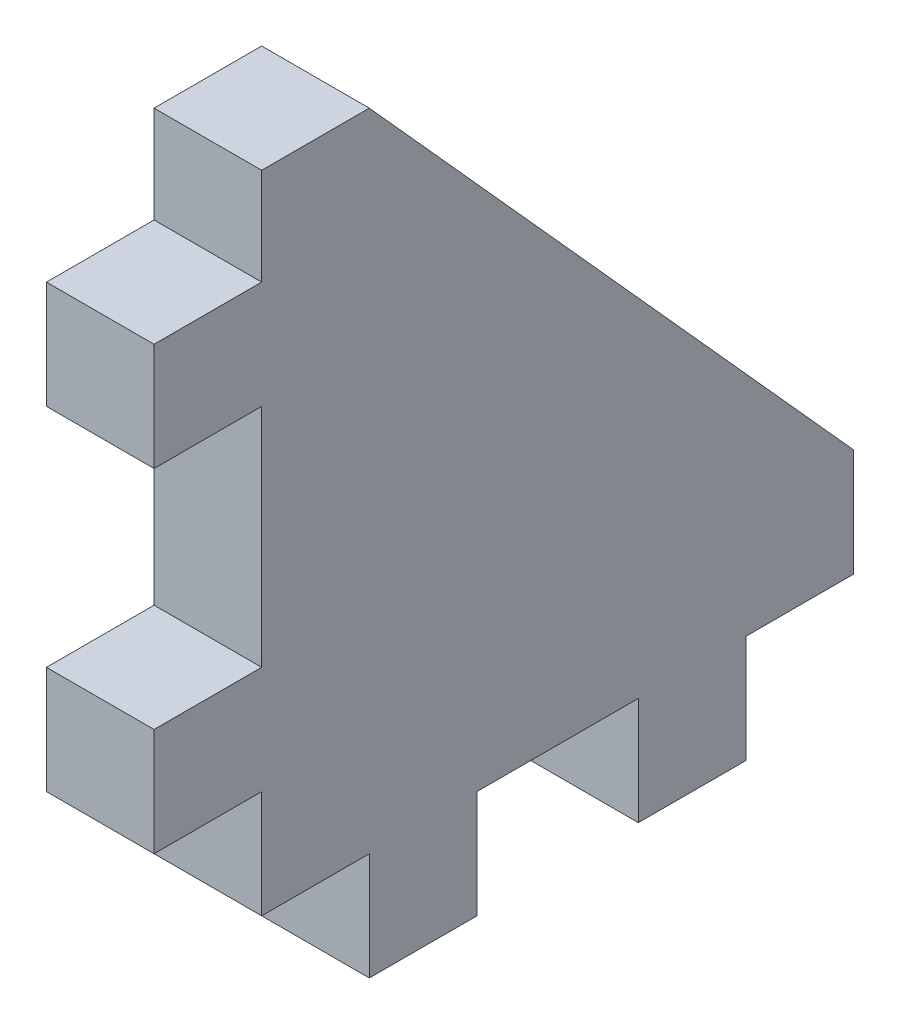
SolidWorks part; units mm, degrees
ref_plane "Piano frontale" through (0, 0, 0) normal (0, 0, 1) x (1, 0, 0)
ref_plane "Piano superiore" through (0, 0, 0) normal (0, 1, 0) x (1, 0, 0)
ref_plane "Piano destro" through (0, 0, 0) normal (1, 0, 0) x (0, 0, -1)
sketch "Schizzo1" plane through (0, 0, 0) normal (1, 0, 0) x (0, 0, -1)
  line L8 (0, 40) -> (0, 82)
  line L23 (0, 0) -> (20, 0) construction
  line L24 (0, 120) -> (0, 102) construction
  line L25 (40, 0) -> (70, 0)
  line L26 (90, 0) -> (110, 0)
  line L27 (40, -20) -> (40, 0)
  line L28 (20, -20) -> (40, -20)
  line L29 (20, 0) -> (20, -20)
  line L30 (70, -20) -> (70, 0)
  line L31 (90, -20) -> (70, -20)
  line L32 (90, 0) -> (90, -20)
  line L33 (0, 102) -> (0, 120)
  line L34 (-20, 82) -> (0, 82)
  line L35 (-20, 102) -> (-20, 82)
  line L36 (0, 102) -> (-20, 102)
  line L37 (-20, 40) -> (0, 40)
  line L38 (-20, 20) -> (-20, 40)
  line L39 (0, 20) -> (-20, 20)
  line L40 (110, 20) -> (20, 120)
  line L41 (0, 120) -> (20, 120)
  line L42 (0, 0) -> (0, 20)
  line L43 (110, 0) -> (110, 20)
  line L44 (0, 0) -> (20, 0)
  dimension "D1" = 20
  dimension "D2" = 70
  dimension "D3" = 82
  dimension "D4" = 120
extrude "Estrusione-Estrusione1" add sketch "Schizzo1" along normal blind 20
